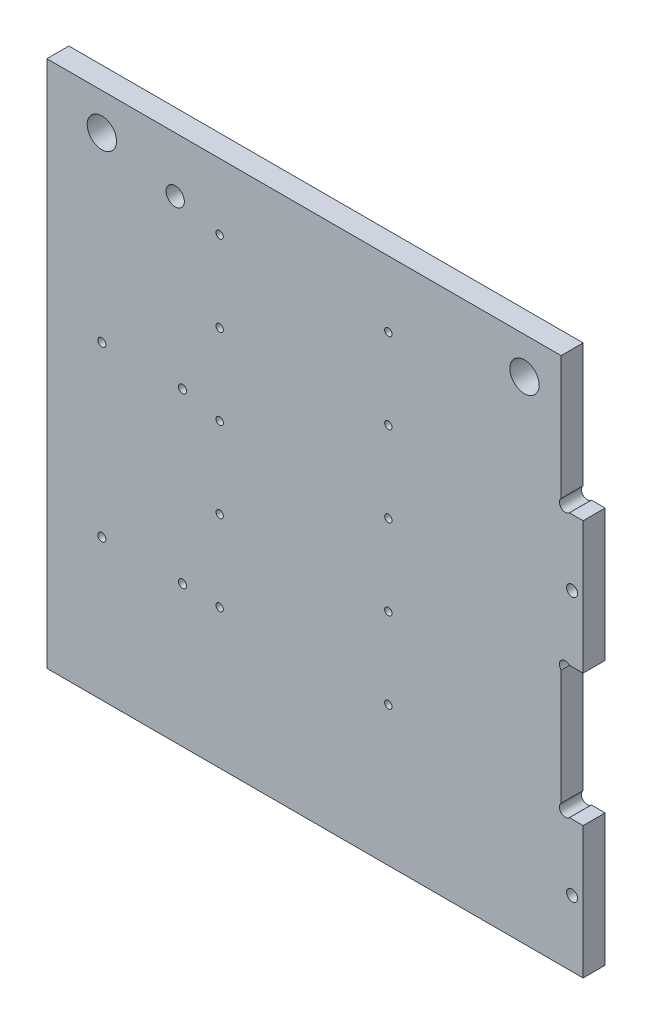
SolidWorks part; units mm, degrees
ref_plane "Plan de face" through (0, 0, 0) normal (0, 0, 1) x (1, 0, 0)
ref_plane "Plan de dessus" through (0, 0, 0) normal (0, 1, 0) x (1, 0, 0)
ref_plane "Plan de droite" through (0, 0, 0) normal (1, 0, 0) x (0, 0, -1)
sketch "Esquisse1" plane through (0, 0, 0) normal (0, 0, 1) x (1, 0, 0)
  line L0 (0, 0) -> (0, 144)
  line L1 (55, 0) -> (-55, 0) construction
  line L2 (0, -55) -> (0, 55) construction
  line L3 (0, 144) -> (140.25, 144)
  line L4 (140.25, 144) -> (140.25, 108)
  line L5 (140.25, 108) -> (146.25, 108)
  line L6 (146.25, 108) -> (146.25, 72)
  line L7 (146.25, 72) -> (140.25, 72)
  line L8 (140.25, 72) -> (140.25, 36)
  line L9 (140.25, 36) -> (146.25, 36)
  line L10 (146.25, 36) -> (146.25, 0)
  line L11 (0, 0) -> (146.25, 0)
  dimension "D1" = 144
  dimension "D2" = 6
  dimension "D3" = 146.25
extrude "Extrusion1" add sketch "Esquisse1" along normal blind 6
sketch "Esquisse2" plane through (0, 0, 6) normal (0, 0, 1) x (1, 0, 0)
  line L0 (140.25, 36) -> (156.0971, 51.8471) construction
  line L1 (146.25, 36) -> (140.25, 36) construction
  line L2 (140.25, 36) -> (140.25, 72) construction
  line L3 (140.25, 72) -> (154.0599, 58.1901) construction
  line L4 (140.25, 108) -> (152.212, 119.962) construction
  line L5 (140.25, 108) -> (140.25, 144) construction
  line L6 (146.25, 108) -> (140.25, 108) construction
  line L7 (140.25, 72) -> (146.25, 72) construction
  circle A0 centre (141.3814, 109.1314) radius 1.6
  circle A1 centre (141.3814, 70.8686) radius 1.6
  circle A2 centre (141.3814, 37.1314) radius 1.6
  dimension "D1" = 3.2
  dimension "D3" = 3.2
  dimension "D5" = 3.2
  dimension "D2" = 45
  dimension "D4" = 45
  dimension "D6" = 45
extrude "Enlèv. mat.-Extru.1" cut sketch "Esquisse2" against normal through all
sketch "Esquisse3" plane through (0, 0, 6) normal (0, 0, 1) x (1, 0, 0)
  line L0 (0, 134) -> (140.25, 134) construction
  line L1 (0, 144) -> (0, 0) construction
  line L2 (140.25, 110.2627) -> (140.25, 144) construction
  line L3 (140.25, 144) -> (0, 144) construction
  circle A0 centre (15, 134) radius 4
  circle A1 centre (130.25, 134) radius 4
  point P12 (140.25, 127.1314)
  dimension "D2" = 8
  dimension "D1" = 10
  dimension "D3" = 15
  dimension "D4" = 10
extrude "Enlèv. mat.-Extru.2" cut sketch "Esquisse3" against normal through all
sketch "Esquisse4" plane through (0, 0, 6) normal (0, 0, 1) x (1, 0, 0)
  line L0 (70.125, 0) -> (70.125, 144) construction
  line L1 (0, 0) -> (146.25, 0) construction
  line L2 (140.25, 144) -> (0, 144) construction
  line L3 (0, 126) -> (150.5, 126) construction
  line L4 (0, 104) -> (146.25, 104) construction
  line L5 (146.25, 82) -> (0, 82) construction
  line L6 (140.25, 60) -> (0, 60) construction
  line L7 (146.25, 90) -> (124.4189, 90) construction
  line L8 (0, 144) -> (0, 0) construction
  line L9 (140.25, 38.2627) -> (140.25, 69.7373) construction
  line L10 (146.25, 72) -> (146.25, 108) construction
  line L11 (146.25, 18) -> (128.7236, 18) construction
  line L12 (47.125, 144) -> (47.125, 0) construction
  line L13 (93.125, 0) -> (93.125, 144) construction
  line L14 (0, 38) -> (139.6831, 38) construction
  line L15 (146.25, 0) -> (146.25, 36) construction
  line L16 (143.25, 0) -> (143.25, 155.7914) construction
  circle A0 centre (93.125, 126) radius 1
  circle A1 centre (47.125, 126) radius 1
  circle A2 centre (47.125, 104) radius 1
  circle A3 centre (47.125, 82) radius 1
  circle A4 centre (47.125, 60) radius 1
  circle A5 centre (93.125, 60) radius 1
  circle A6 centre (93.125, 82) radius 1
  circle A7 centre (93.125, 104) radius 1
  circle A8 centre (93.125, 38) radius 1
  circle A9 centre (47.125, 38) radius 1
  circle A10 centre (143.25, 90) radius 1.5
  circle A11 centre (143.25, 18) radius 1.5
  dimension "D6" = 2
  dimension "D9" = 3
  dimension "D1" = 18
  dimension "D2" = 22
  dimension "D3" = 22
  dimension "D4" = 22
  dimension "D5" = 46
  dimension "D7" = 22
  dimension "D8" = 3
extrude "Enlèv. mat.-Extru.3" cut sketch "Esquisse4" against normal through all
sketch "Esquisse5" plane through (0, 0, 0) normal (0, 0, -1) x (-1, 0, 0)
  line L0 (0, 61.5) -> (-73.5722, 61.5) construction
  line L1 (0, 144) -> (0, 0) construction
  line L2 (0, 0) -> (-146.25, 0) construction
  line L3 (-15, 29.2913) -> (-15, 101.0687) construction
  line L4 (-37, 29.2913) -> (-37, 101.0687) construction
  line L5 (-48.0812, 84.5) -> (13.1868, 84.5) construction
  line L6 (-46.0687, 38.5) -> (-7.8322, 38.5) construction
  circle A0 centre (-15, 84.5) radius 1.1
  circle A1 centre (-37, 84.5) radius 1.1
  circle A2 centre (-37, 38.5) radius 1.1
  circle A3 centre (-15, 38.5) radius 1.1
  dimension "D6" = 2.2
  dimension "D1" = 61.5
  dimension "D2" = 22
  dimension "D3" = 46
  dimension "D4" = 23
  dimension "D5" = 15
extrude "Enlèv. mat.-Extru.4" cut sketch "Esquisse5" against normal through all
sketch "Esquisse6" plane through (0, 0, 0) normal (0, 0, -1) x (-1, 0, 0)
  line L0 (-140.25, 144) -> (0, 144) construction
  line L1 (0, 144) -> (0, 0) construction
  circle A0 centre (-35, 129) radius 2.5
  dimension "D1" = 15
  dimension "D2" = 35
  dimension "D3" = 5
extrude "Enlèv. mat.-Extru.5" cut sketch "Esquisse6" against normal through all
